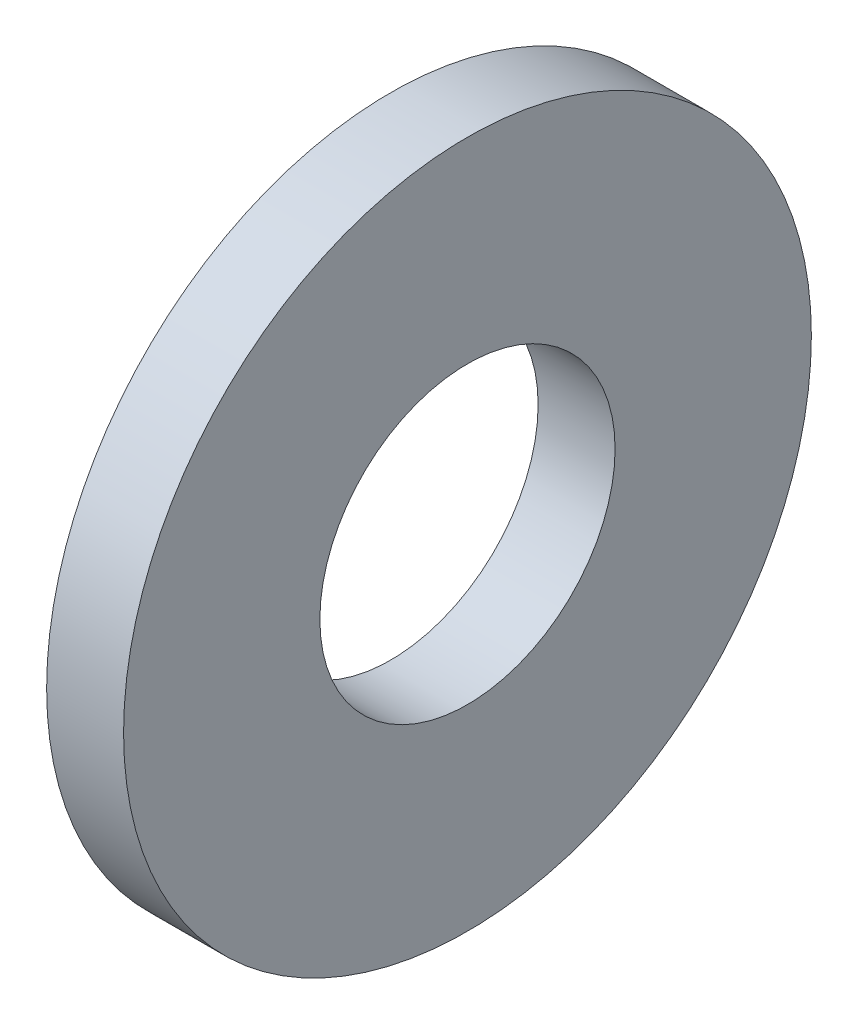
SolidWorks part; units mm, degrees
ref_plane "Plane1" through (0, 0, 0) normal (0, 0, 1) x (1, 0, 0)
ref_plane "Plane2" through (0, 0, 0) normal (0, 1, 0) x (1, 0, 0)
ref_plane "Plane3" through (0, 0, 0) normal (1, 0, 0) x (0, 0, -1)
sketch "Sketch1" plane through (0, 0, 0) normal (0, 0, 1) x (1, 0, 0)
  line L0 (-34.925, 0) -> (9.525, 0) construction
  line L1 (0, 2.3876) -> (0, 5.5626)
  line L2 (0, 5.5626) -> (-1.2446, 5.5626)
  line L3 (-1.2446, 5.5626) -> (-1.2446, 2.3876)
  line L4 (-1.2446, 2.3876) -> (0, 2.3876)
  dimension "Thickness" = 1.2446
  dimension "Inside_dia" = 4.7752
  dimension "Outside_dia" = 11.1252
revolve "Base-Revolve" add sketch "Sketch1" angle 360 about L0
